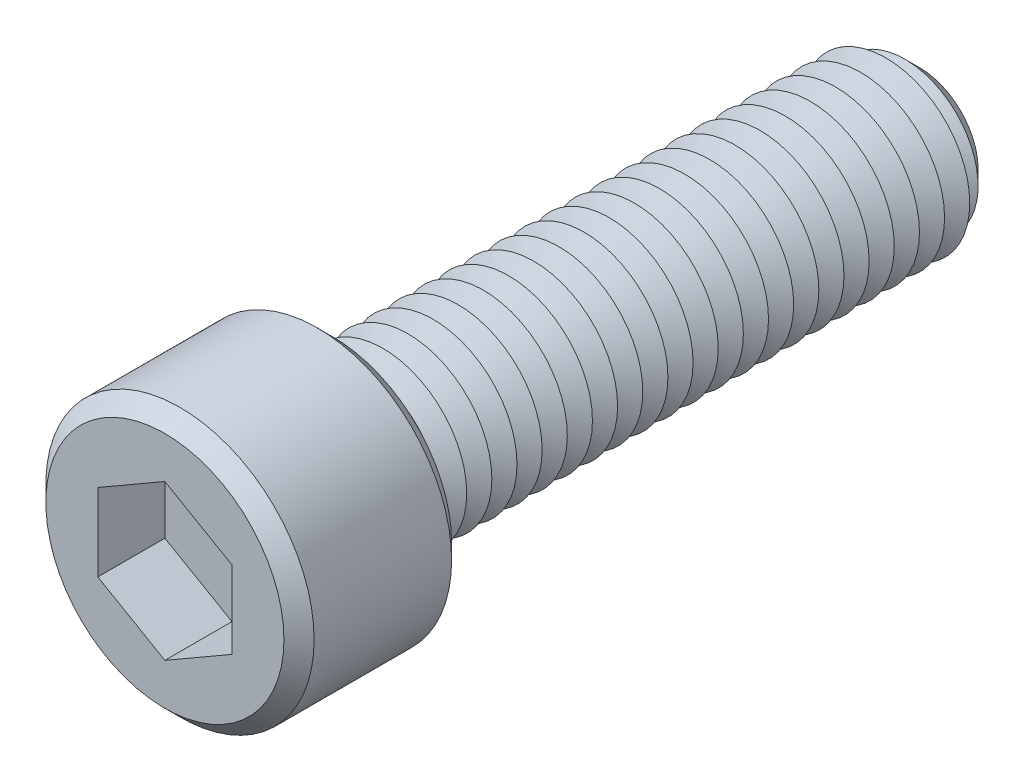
SolidWorks part; units mm, degrees
ref_plane "Front Plane" through (0, 0, 0) normal (0, 0, 1) x (1, 0, 0)
ref_plane "Top Plane" through (0, 0, 0) normal (0, 1, 0) x (1, 0, 0)
ref_plane "Right Plane" through (0, 0, 0) normal (1, 0, 0) x (0, 0, -1)
sketch "Sketch1" plane through (0, 0, 0) normal (0, 0, 1) x (1, 0, 0)
  circle A0 centre (0, 0) radius 8
  dimension "D1" = 16
extrude "Boss-Extrude1" add sketch "Sketch1" along normal blind 10
sketch "Sketch2" plane through (0, 0, 0) normal (0, 0, -1) x (-1, 0, 0)
  circle A0 centre (0, 0) radius 5
  dimension "D1" = 10
extrude "Boss-Extrude2" add sketch "Sketch2" along normal blind 35
chamfer "Chamfer1" distance 1.5 angle 45 1 edges at (-5, 0, -35)
sketch "Sketch3" plane through (0, 0, 0) normal (1, 0, 0) x (0, 0, -1)
  line L0 (-2.5121, 0) -> (4.5776, 0) construction
sketch "Sketch4" plane through (0, 0, 0) normal (1, 0, 0) x (0, 0, -1)
  line L0 (0, 5) -> (0.75, 3.701)
  line L1 (0.75, 3.701) -> (1.5, 5)
  line L2 (33.5, 5) -> (0, 5) construction
  line L3 (1.5, 5) -> (0, 5)
  dimension "D1" = 1.5
revolve "Cut-Revolve1" cut sketch "Sketch4" angle 360 about L0
pattern_linear "LPattern1" count 23 spacing 1.5 along (0, 0, -1) of "Cut-Revolve1"
sketch "Sketch5" plane through (0, 0, 10) normal (0, 0, 1) x (1, 0, 0)
  line L1 (0, 4.6188) -> (-4, 2.3094)
  line L2 (-4, 2.3094) -> (-4, -2.3094)
  line L3 (-4, -2.3094) -> (0, -4.6188)
  line L4 (0, -4.6188) -> (4, -2.3094)
  line L5 (4, -2.3094) -> (4, 2.3094)
  line L6 (4, 2.3094) -> (0, 4.6188)
  circle A0 centre (0, 0) radius 4 construction
  dimension "D1" = 8
extrude "Cut-Extrude1" cut sketch "Sketch5" against normal blind 4
sketch "Sketch6" plane through (0, 0, 6) normal (0, 0, 1) x (1, 0, 0)
  circle A0 centre (0, 0) radius 0.9
  dimension "D1" = 1.8
extrude "Cut-Extrude2" cut sketch "Sketch6" against normal up to surface (41 mm away)
chamfer "Chamfer2" distance 0.9 angle 45 2 edges at (8, 0, 0) (8, 0, 10)
